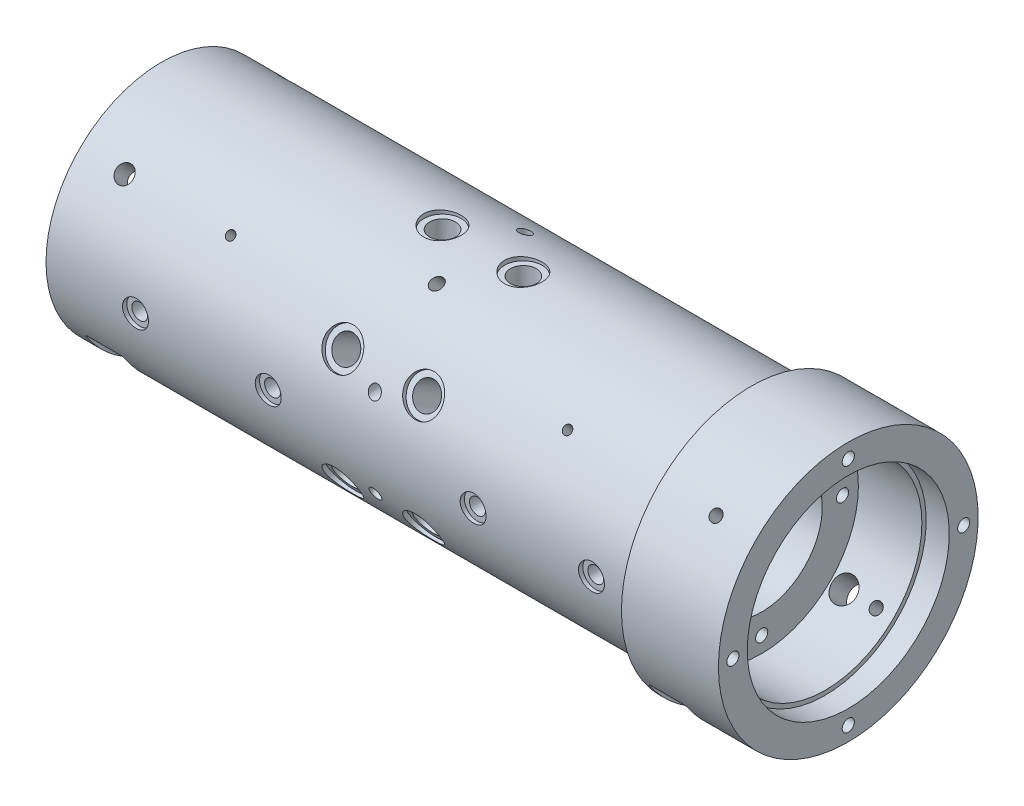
SolidWorks part; units mm, degrees
ref_plane "Front Plane" through (0, 0, 0) normal (0, 0, 1) x (1, 0, 0)
ref_plane "Top Plane" through (0, 0, 0) normal (0, 1, 0) x (1, 0, 0)
ref_plane "Right Plane" through (0, 0, 0) normal (1, 0, 0) x (0, 0, -1)
sketch "Sketch1" plane through (0, 0, 0) normal (0, 0, 1) x (1, 0, 0)
  line L0 (19, 21) -> (208, 21)
  line L1 (208, 21) -> (208, 33.5)
  line L2 (208, 33.5) -> (230, 33.5)
  line L3 (230, 33.5) -> (230, 35)
  line L4 (230, 35) -> (238, 35)
  line L8 (238, 35) -> (238, 45)
  line L9 (238, 45) -> (204.4, 45)
  line L10 (204.4, 45) -> (204.4, 40)
  line L11 (204.4, 40) -> (0, 40)
  line L12 (0, 0) -> (296.0083, 0) construction
  line L13 (19, 21) -> (19, 33.5)
  line L14 (19, 33.5) -> (0, 33.5)
  line L15 (0, 33.5) -> (0, 40)
  dimension "D1" = 21
  dimension "D2" = 33.5
  dimension "D3" = 35
  dimension "D4" = 45
  dimension "D5" = 40
  dimension "D6" = 8
  dimension "D7" = 22
  dimension "D8" = 6.5
  dimension "D9" = 19
  dimension "D10" = 33.6
revolve "Revolve1" add sketch "Sketch1" angle 360 about L12
hole_wizard "M5x0.8 Tapped Hole1" positions "3DSketch1" profile "Sketch2" tap size "M5x0.8" standard "ANSI Metric"
sketch3d "3DSketch1"
  line L4 (208, 0, 0) -> (19, 0, 0) construction
  point P0 (208, 28, 0)
  point P32 (238, 40, 0)
  dimension "D1" = 28
  dimension "D2" = 40
sketch "Sketch2" plane through (208, 28, 0) normal (0, 1, 0) x (0, 0, -1)
  line L0 (0, 0) -> (0, 13.6618)
  line L1 (0, 13.6618) -> (2.1, 12.4)
  line L2 (2.1, 12.4) -> (2.1, 0)
  line L5 (2.1, 0) -> (0, 0)
  line L10 (0, 13.6618) -> (-2.1, 12.4) construction
  line L11 (0, -6.35) -> (0, 107.95) construction
  dimension "Tap Drill Dia." = 4.2
  dimension "Tap Drill Depth" = 12.4
  dimension "Drill Angle" = 118
hole_wizard "CBORE for M8 Hex Head Bolt1" positions "3DSketch5" profile "Sketch5" counterbore size "M8" standard "ANSI Metric"
sketch3d "3DSketch5"
  point P0 (125.4, 40, 0)
  point P2 (97.4, 40, 0)
  dimension "D1" = 28
  dimension "D2" = 79
sketch "Sketch5" plane through (125.4, 40, 0) normal (1, 0, 0) x (0, 0, 1)
  line L0 (0, 0) -> (0, 19)
  line L1 (0, 19) -> (4.5, 19)
  line L3 (4.5, 19) -> (4.5, 1.5)
  line L4 (4.5, 1.5) -> (6.5, 1.5)
  line L5 (6.5, 1.5) -> (6.5, 0)
  line L7 (6.5, 0) -> (0, 0)
  line L11 (0, -6.35) -> (0, 107.95) construction
  dimension "Thru Hole Dia." = 9
  dimension "Thru Hole Depth" = 19
  dimension "C'Bore Dia." = 13
  dimension "C'Bore Depth" = 1.5
pattern_circular "CirPattern3" count 6 over 360 about axis through (0, 0, 0) along (1, 0, 0) of "CBORE for M8 Hex Head Bolt1"
hole_wizard "CBORE for M5 Hex Head Bolt1" positions "3DSketch6" profile "Sketch6" counterbore size "M5" standard "ANSI Metric"
sketch3d "3DSketch6"
  point P0 (31, 0, 40)
  point P2 (77, 0, 40)
  point P4 (148, 0, 40)
  point P6 (189, 0, 40)
  dimension "D1" = 31
  dimension "D2" = 46
  dimension "D3" = 71
  dimension "D4" = 41
sketch "Sketch6" plane through (31, 0, 40) normal (1, 0, 0) x (0, -1, 0)
  line L0 (0, 0) -> (0, 19)
  line L1 (0, 19) -> (2.75, 19)
  line L3 (2.75, 19) -> (2.75, 1.5)
  line L4 (2.75, 1.5) -> (4.5, 1.5)
  line L5 (4.5, 1.5) -> (4.5, 0)
  line L7 (4.5, 0) -> (0, 0)
  line L11 (0, -6.35) -> (0, 107.95) construction
  dimension "Thru Hole Dia." = 5.5
  dimension "Thru Hole Depth" = 19
  dimension "C'Bore Dia." = 9
  dimension "C'Bore Depth" = 1.5
hole_wizard "Ø8.0mm Dowel Hole1" positions "3DSketch7" profile "Sketch7" hole size "Ø8.0" standard "ANSI Metric"
sketch3d "3DSketch7"
  line L2 (0, 0, 0) -> (241.0692, 0, 0) construction
  line L4 (212.9, -31.8198, -31.8198) -> (212.9, 0, 0) construction
  line L8 (212.9, 0, 0) -> (212.9, 44.6784, 0) construction
  point P0 (212.9, -31.8198, -31.8198)
  dimension "D1" = 8.5
  dimension "D2" = 135
sketch "Sketch7" plane through (212.9, -31.8198, -31.8198) normal (1, 0, 0) x (0, 0.7071, -0.7071)
  line L0 (0, 0) -> (0, 11.5)
  line L1 (0, 11.5) -> (4.25, 11.5)
  line L2 (4.25, 11.5) -> (4.25, 0)
  line L5 (4.25, 0) -> (0, 0)
  line L11 (0, -6.35) -> (0, 107.95) construction
  dimension "Thru Hole Dia." = 8.5
  dimension "Thru Hole Depth" = 11.5
hole_wizard "M5x0.8 Tapped Hole3" positions "3DSketch8" profile "Sketch8" tap size "M5x0.8" standard "ANSI Metric"
sketch3d "3DSketch8"
  line L0 (208, 0, 0) -> (19, 0, 0) construction
  point P0 (19, 28, 0)
  dimension "D1" = 28
sketch "Sketch8" plane through (19, 28, 0) normal (0, 1, 0) x (0, 0, 1)
  line L0 (0, 0) -> (0, 13.6618)
  line L1 (0, 13.6618) -> (2.1, 12.4)
  line L2 (2.1, 12.4) -> (2.1, 0)
  line L5 (2.1, 0) -> (0, 0)
  line L10 (0, 13.6618) -> (-2.1, 12.4) construction
  line L11 (0, -6.35) -> (0, 107.95) construction
  dimension "Tap Drill Dia." = 4.2
  dimension "Tap Drill Depth" = 12.4
  dimension "Drill Angle" = 118
hole_wizard "M2.5x0.45 Tapped Hole1" positions "3DSketch9" profile "Sketch9" tap size "M2.5x0.45" standard "ANSI Metric"
sketch3d "3DSketch9"
  line L0 (208, 0, 0) -> (19, 0, 0) construction
  point P0 (0, 38, 0)
  dimension "D1" = 38
sketch "Sketch9" plane through (0, 38, 0) normal (0, 1, 0) x (0, 0, 1)
  line L0 (0, 0) -> (0, 6.9659)
  line L1 (0, 6.9659) -> (1.025, 6.35)
  line L2 (1.025, 6.35) -> (1.025, 0)
  line L5 (1.025, 0) -> (0, 0)
  line L10 (0, 6.9659) -> (-1.025, 6.35) construction
  line L11 (0, -6.35) -> (0, 107.95) construction
  dimension "Tap Drill Dia." = 2.05
  dimension "Tap Drill Depth" = 6.35
  dimension "Drill Angle" = 118
hole_wizard "Ø6.0mm Dowel Hole1" positions "3DSketch10" profile "Sketch12" hole size "Ø6.0" standard "ANSI Metric"
sketch3d "3DSketch10"
  line L0 (0, 0, 0) -> (15.5, 0, 0) construction
  line L1 (15.5, 0, 0) -> (15.5, 0, -48.2346) construction
  line L3 (15.5, 0, 0) -> (15.5, 28.2843, 28.2843) construction
  point P0 (15.5, 28.2843, 28.2843)
  dimension "D1" = 15.5
  dimension "D2" = 135
sketch "Sketch12" plane through (15.5, 28.2843, 28.2843) normal (1, 0, 0) x (0, -0.7071, 0.7071)
  line L0 (0, 0) -> (0, 6.5)
  line L1 (0, 6.5) -> (3, 6.5)
  line L2 (3, 6.5) -> (3, 0)
  line L5 (3, 0) -> (0, 0)
  line L11 (0, -6.35) -> (0, 107.95) construction
  dimension "Thru Hole Dia." = 6
  dimension "Thru Hole Depth" = 6.5
pattern_circular "CirPattern5" count 2 every 90 about axis through (0, 0, 0) along (-1, 0, 0) of "Ø6.0mm Dowel Hole1"
hole_wizard "Ø8.0mm Dowel Hole2" positions "3DSketch11" profile "Sketch13" hole size "Ø8.0" standard "ANSI Metric"
sketch3d "3DSketch11"
  line L0 (0, 0, 0) -> (14.25, 0, 0) construction
  line L2 (14.25, 0, 0) -> (14.25, 0, -47.7831) construction
  line L3 (14.25, 0, 0) -> (14.25, -28.2843, -28.2843) construction
  point P0 (14.25, -28.2843, -28.2843)
  dimension "D2" = 14.25
  dimension "D3" = 45
sketch "Sketch13" plane through (14.25, -28.2843, -28.2843) normal (1, 0, 0) x (0, 0.7071, -0.7071)
  line L0 (0, 0) -> (0, 6.5)
  line L1 (0, 6.5) -> (4.25, 6.5)
  line L2 (4.25, 6.5) -> (4.25, 0)
  line L5 (4.25, 0) -> (0, 0)
  line L11 (0, -6.35) -> (0, 107.95) construction
  dimension "Thru Hole Dia." = 8.5
  dimension "Thru Hole Depth" = 6.5
ref_plane "Plane1" through (0, -28.2843, -28.2843) normal (0, -0.7071, -0.7071) x (-1, 0, 0)
sketch "Sketch14" plane through (0, -28.2843, -28.2843) normal (0, -0.7071, -0.7071) x (-1, 0, 0)
  line L0 (-21, -8.25) -> (-21, 9.75)
  line L1 (-20, 10.75) -> (-8.5, 10.75)
  line L2 (-7.5, 9.75) -> (-7.5, -8.25)
  line L3 (-8.5, -9.25) -> (-20, -9.25)
  line L4 (0, -40) -> (0, 40) construction
  arc A0 (-21, -8.25) -> (-20, -9.25) centre (-20, -8.25) ccw
  circle A1 centre (-14.25, 0) radius 4.25 construction
  arc A6 (-7.5, -8.25) -> (-8.5, -9.25) centre (-8.5, -8.25) cw
  arc A7 (-8.5, 10.75) -> (-7.5, 9.75) centre (-8.5, 9.75) cw
  arc A8 (-21, 9.75) -> (-20, 10.75) centre (-20, 9.75) cw
  point P10 (-21, -9.25)
  point P15 (-7.5, 10.75)
  point P18 (-21, 10.75)
  dimension "D3" = 7.5
  dimension "D5" = 1
  dimension "D1" = 13.5
  dimension "D2" = 20
  dimension "D4" = 10.75
extrude "Cut-Extrude1" cut sketch "Sketch14" against normal blind 3
ref_plane "Plane2" through (0, -31.8198, -31.8198) normal (0, -0.7071, -0.7071) x (-1, 0, 0)
sketch "Sketch16" plane through (0, -31.8198, -31.8198) normal (0, -0.7071, -0.7071) x (-1, 0, 0)
  line L0 (-219.65, -8.25) -> (-219.65, 9.75)
  line L1 (-218.65, 10.75) -> (-207.15, 10.75)
  line L2 (-206.15, 9.75) -> (-206.15, -8.25)
  line L3 (-207.15, -9.25) -> (-218.65, -9.25)
  line L4 (-204.4, -40) -> (-204.4, 40) construction
  circle A0 centre (-212.9, 0) radius 4.25 construction
  arc A1 (-219.65, -8.25) -> (-218.65, -9.25) centre (-218.65, -8.25) ccw
  arc A2 (-206.15, -8.25) -> (-207.15, -9.25) centre (-207.15, -8.25) cw
  arc A3 (-207.15, 10.75) -> (-206.15, 9.75) centre (-207.15, 9.75) cw
  arc A4 (-219.65, 9.75) -> (-218.65, 10.75) centre (-218.65, 9.75) cw
  point P11 (-219.65, -9.25)
  point P16 (-206.15, 10.75)
  point P19 (-219.65, 10.75)
  dimension "D5" = 1
  dimension "D1" = 20
  dimension "D2" = 13.5
  dimension "D3" = 1.75
  dimension "D4" = 9.25
extrude "Cut-Extrude2" cut sketch "Sketch16" against normal blind 3
hole_wizard "M2x0.4 Tapped Hole1" positions "3DSketch12" profile "Sketch17" tap size "M2x0.4" standard "ANSI Metric"
sketch3d "3DSketch12"
  line L0 (216.4, -34.2947, -25.1023) -> (209.4, -34.2947, -25.1023) construction
  line L2 (207.15, -37.681, -24.5996) -> (218.65, -37.681, -24.5996) construction
  circle A0 centre (212.9, -29.6985, -29.6985) radius 4.25 construction
  point P0 (216.4, -34.2947, -25.1023)
  point P2 (209.4, -34.2947, -25.1023)
  point P20 (212.9, -26.6933, -26.6933)
  dimension "D1" = 7
  dimension "D2" = 3.25
  dimension "D3" = 6.5
sketch "Sketch17" plane through (216.4, -34.2947, -25.1023) normal (1, 0, 0) x (0, 0.7071, -0.7071)
  line L0 (0, 0) -> (0, 5.6807)
  line L1 (0, 5.6807) -> (0.8, 5.2)
  line L2 (0.8, 5.2) -> (0.8, 0)
  line L5 (0.8, 0) -> (0, 0)
  line L10 (0, 5.6807) -> (-0.8, 5.2) construction
  line L11 (0, -6.35) -> (0, 107.95) construction
  dimension "Tap Drill Dia." = 1.6
  dimension "Tap Drill Depth" = 5.2
  dimension "Drill Angle" = 118
hole_wizard "M2x0.4 Tapped Hole2" positions "3DSketch13" profile "Sketch18" tap size "M2x0.4" standard "ANSI Metric"
sketch3d "3DSketch13"
  line L0 (17.75, -30.7591, -21.5668) -> (10.75, -30.7591, -21.5668) construction
  line L2 (20, -32.7037, -19.6222) -> (8.5, -32.7037, -19.6222) construction
  circle A0 centre (14.25, -26.163, -26.163) radius 4.25 construction
  point P0 (10.75, -30.7591, -21.5668)
  point P2 (17.75, -30.7591, -21.5668)
  point P12 (14.25, -23.1577, -23.1577)
  dimension "D1" = 7
  dimension "D2" = 6.5
  dimension "D3" = 3.25
sketch "Sketch18" plane through (10.75, -30.7591, -21.5668) normal (1, 0, 0) x (0, 0.7071, -0.7071)
  line L0 (0, 0) -> (0, 5.6807)
  line L1 (0, 5.6807) -> (0.8, 5.2)
  line L2 (0.8, 5.2) -> (0.8, 0)
  line L5 (0.8, 0) -> (0, 0)
  line L10 (0, 5.6807) -> (-0.8, 5.2) construction
  line L11 (0, -6.35) -> (0, 107.95) construction
  dimension "Tap Drill Dia." = 1.6
  dimension "Tap Drill Depth" = 5.2
  dimension "Drill Angle" = 118
pattern_circular "CirPattern4" count 2 every 90 about axis through (0, 0, 0) along (1, 0, 0) of "Ø8.0mm Dowel Hole1", "Ø8.0mm Dowel Hole2", "Cut-Extrude1", "Cut-Extrude2", "M2x0.4 Tapped Hole1", "M2x0.4 Tapped Hole2"
sketch "Sketch20" plane through (0, -31.8198, -31.8198) normal (0, -0.7071, -0.7071) x (-1, 0, 0)
  line L0 (-238, 45) -> (-238, -45) construction
  line L1 (-208, 0) -> (-19, 0) construction
  circle A0 centre (-224, 0) radius 2
  dimension "D1" = 4
  dimension "D2" = 14
extrude "Cut-Extrude3" cut sketch "Sketch20" against normal up to next
sketch "Sketch21" plane through (0, -28.2843, -28.2843) normal (0, -0.7071, -0.7071) x (-1, 0, 0)
  line L0 (0, -40) -> (0, 40) construction
  line L1 (-208, 0) -> (-19, 0) construction
  circle A0 centre (-52.25, 0) radius 1.5
  circle A1 centre (-169, 0) radius 1.5
  dimension "D1" = 3
  dimension "D3" = 3
  dimension "D2" = 52.25
  dimension "D4" = 169
extrude "Cut-Extrude4" cut sketch "Sketch21" against normal up to next
pattern_circular "CirPattern1" count 4 over 360 about axis through (0, 0, 0) along (1, 0, 0) of "M5x0.8 Tapped Hole1", "M5x0.8 Tapped Hole3", "M2.5x0.45 Tapped Hole1", "Cut-Extrude3", "Cut-Extrude4"
ref_plane "Plane4" through (0, 40, 0) normal (0, 1, 0) x (1, 0, 0)
sketch "Sketch25" plane through (0, 40, 0) normal (0, 1, 0) x (1, 0, 0)
  circle A0 centre (111, 15) radius 2.1
  point P5 (0, 0)
  dimension "D3" = 4.2
  dimension "D1" = 111
  dimension "D2" = 15
extrude "Cut-Extrude6" cut sketch "Sketch25" against normal up to next
pattern_circular "CirPattern6" count 8 over 360 about axis through (0, 0, 0) along (-1, 0, 0) of "Cut-Extrude6"
